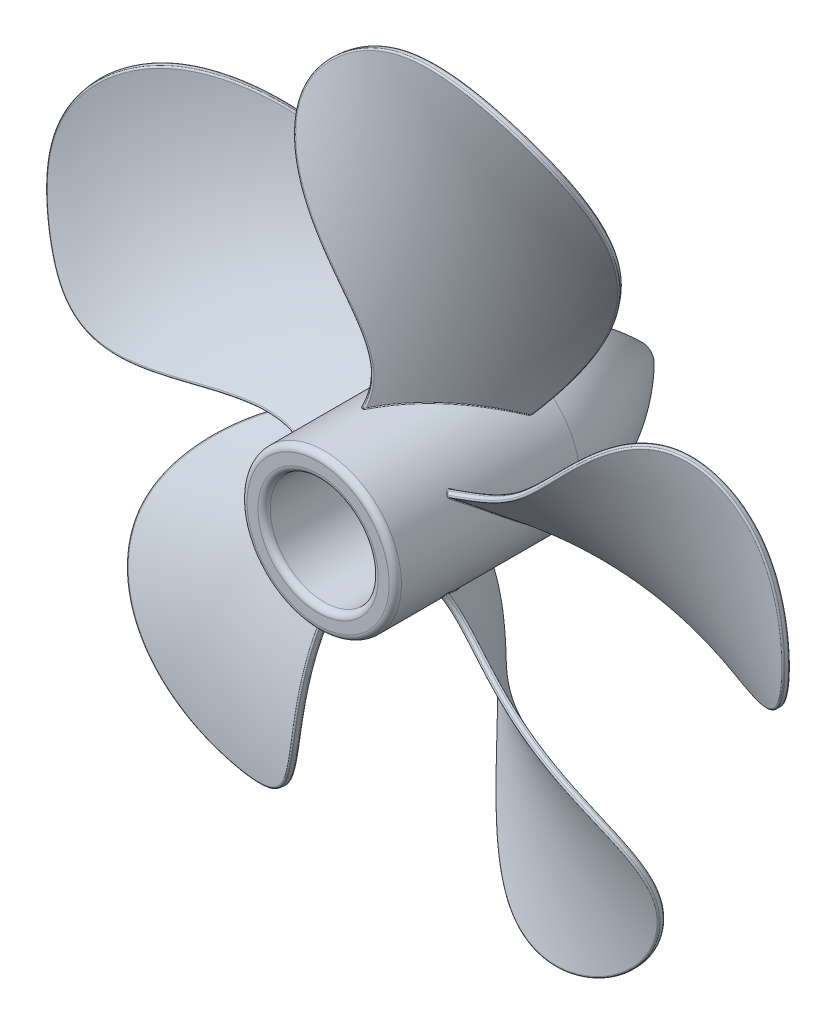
SolidWorks part; units mm, degrees
ref_plane "Front Plane" through (0, 0, 0) normal (0, 0, 1) x (1, 0, 0)
ref_plane "Top Plane" through (0, 0, 0) normal (0, 1, 0) x (1, 0, 0)
ref_plane "Right Plane" through (0, 0, 0) normal (1, 0, 0) x (0, 0, -1)
sketch "Sketch1" plane through (0, 0, 0) normal (0, 0, 1) x (1, 0, 0)
  circle A0 centre (0, 0) radius 12700
  dimension "D1" = 25400
extrude "Boss-Extrude1" add sketch "Sketch1" along normal mid plane 30480
ref_plane "Plane1" through (0, 9525, 0) normal (0, 1, 0) x (1, 0, 0)
ref_plane "Plane2" through (0, 63500, 0) normal (0, 1, 0) x (1, 0, 0)
sketch "Sketch2" plane through (0, 9525, 0) normal (0, 1, 0) x (1, 0, 0)
  line L0 (-17789.1707, 0) -> (18668.4833, 0) construction
  line L1 (-29571.8469, -41305.5187) -> (29571.8469, 41305.5187)
  dimension "D1" = 101600
  dimension "D2" = 54.4
sketch "Sketch3" plane through (0, 63500, 0) normal (0, 1, 0) x (1, 0, 0)
  line L0 (-50800, 0) -> (50800, 0)
  dimension "D1" = 101600
surface "Surface-Loft1"
ref_plane "Plane3" through (0, 0, 76200) normal (0, 0, 1) x (1, 0, 0)
sketch "Sketch4" plane through (0, 0, 76200) normal (0, 0, 1) x (1, 0, 0)
  line L0 (29571.8469, 9525) -> (-29571.8469, 9525) construction
  circle A0 centre (0, 0) radius 12700 construction
  spline S0 degree 3 poles (-4515.4725, 9525) (2815.7828, 23962.7965) (-26697.5531, 46924.9305) (773.8417, 66056.0419) (36977.3359, 52794.4077) (15299.4656, 18490.4147) (8400.2604, 9525) knots 0 0 0 0 0.344967 0.450449 0.644165 1 1 1 1
surface "Surface-Trim1"
thicken "Thicken2" surfaces to thicken 103 thickness 508 thickness side both sides parameters "D1"=508
fillet "Fillet2" radius 254 8 edges at (5053.2968, 11651.3601, -5752.8087) (8254.7388, 9651.3878, -11928.0751) (-3284.1073, 12268.0332, 4613.4226) (4524.1377, 11866.8521, -6700.5399)
fillet "Fillet4" radius 127 14 edges at (-8900.3209, 58767.4343, 915.5698) (-11195.2631, 56906.0113, 911.6562) (4524.1377, 11866.8521, -6700.5399) (-11045.8966, 56677.7105, 679.0313) (5053.2968, 11651.3601, -5752.8087) (-8737.991, 58594.1406, 1185.9121) (8674.3548, 9444.7496, -11479.9969) (-3794.5201, 12119.8852, 4169.3359) (8145.4985, 9743.7597, -12001.0378) (-3096.8255, 12316.6421, 4644.2556)
pattern_circular "CirPattern1" count 5 over 360 about axis through (0, 0, 15240) along (0, 0, -1)
sketch "Sketch5" plane through (0, 0, 0) normal (1, 0, 0) x (0, 0, -1)
  line L0 (15240, 0) -> (38100, 0)
  line L1 (15240, -12700) -> (15240, 12700) construction
  line L2 (38100, 0) -> (38100, 2032)
  line L3 (15240, 0) -> (15240, 12700)
  line L4 (29899.8566, 12700) -> (580.1434, 12700) construction
  spline S0 degree 2 poles (15240, 12700) (27151.6805, 12700) (38100, 2032) knots 0 0 0 1 1 1
  dimension "D1" = 22860
  dimension "D2" = 2032
revolve "Revolve1" add sketch "Sketch5" angle 360 about L0
dome "Dome1" faces to dome 2 distance 762 parameters "D1"=762
sketch "Sketch6" plane through (0, 0, 15240) normal (0, 0, 1) x (1, 0, 0)
  circle A0 centre (0, 0) radius 8890
  dimension "D1" = 17780
extrude "Cut-Extrude1" cut sketch "Sketch6" against normal blind 31750
fillet "Fillet5" radius 1016 2 edges at (12700, 0, 15240) (8890, 0, 15240)
